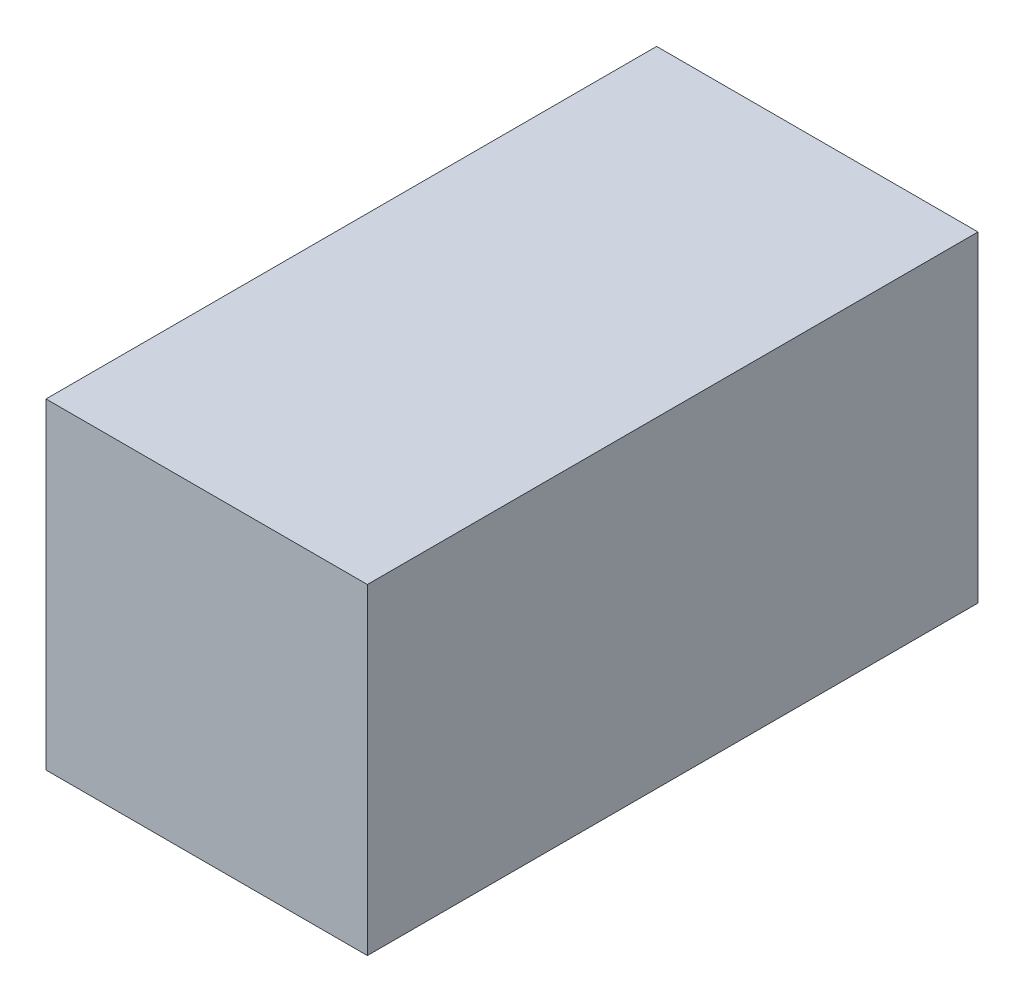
SolidWorks part; units mm, degrees
ref_plane "Front Plane" through (0, 0, 0) normal (0, 0, 1) x (1, 0, 0)
ref_plane "Top Plane" through (0, 0, 0) normal (0, 1, 0) x (1, 0, 0)
ref_plane "Right Plane" through (0, 0, 0) normal (1, 0, 0) x (0, 0, -1)
sketch "Sketch1" plane through (0, 0, 0) normal (0, 0, 1) x (1, 0, 0)
  line L0 (0, 0) -> (0, 50)
  line L1 (0, 50) -> (50, 50)
  line L2 (50, 50) -> (50, 0)
  line L3 (50, 0) -> (0, 0)
  dimension "D1" = 50
  dimension "D2" = 50
extrude "Boss-Extrude1" add sketch "Sketch1" along normal blind 95
